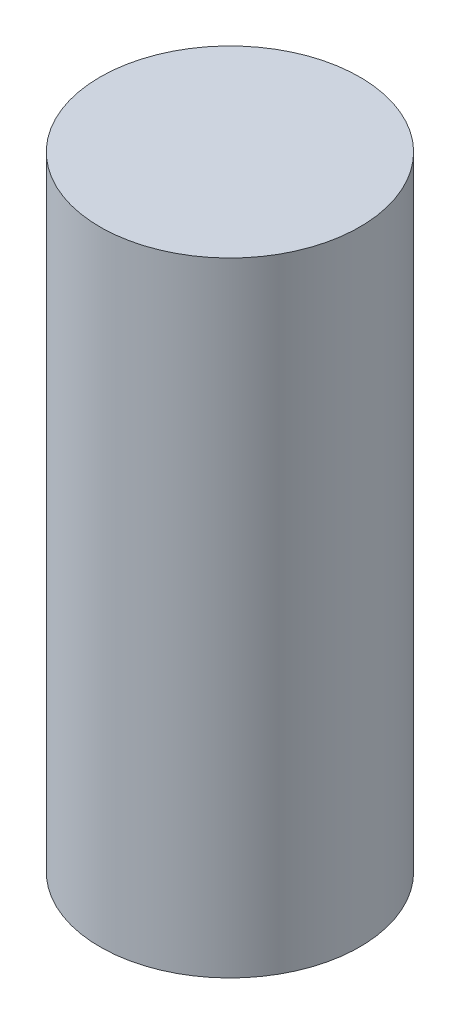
SolidWorks part; units mm, degrees
ref_plane "Plan de face" through (0, 0, 0) normal (0, 0, 1) x (1, 0, 0)
ref_plane "Plan de dessus" through (0, 0, 0) normal (0, 1, 0) x (1, 0, 0)
ref_plane "Plan de droite" through (0, 0, 0) normal (1, 0, 0) x (0, 0, -1)
sketch "Esquisse1" plane through (0, 0, 0) normal (0, 0, 1) x (1, 0, 0)
  line L0 (0, 29.822) -> (0, -30.178) construction
  line L2 (12.5, -30.178) -> (0, -30.178)
  line L3 (12.5, -30.178) -> (12.5, 29.822)
  line L4 (12.5, 29.822) -> (0, 29.822)
  line L5 (0, -30.178) -> (0, 29.822)
  dimension "D1" = 12.5
  dimension "D2" = 60
revolve "Révolution1" add sketch "Esquisse1" angle 360 about L0
